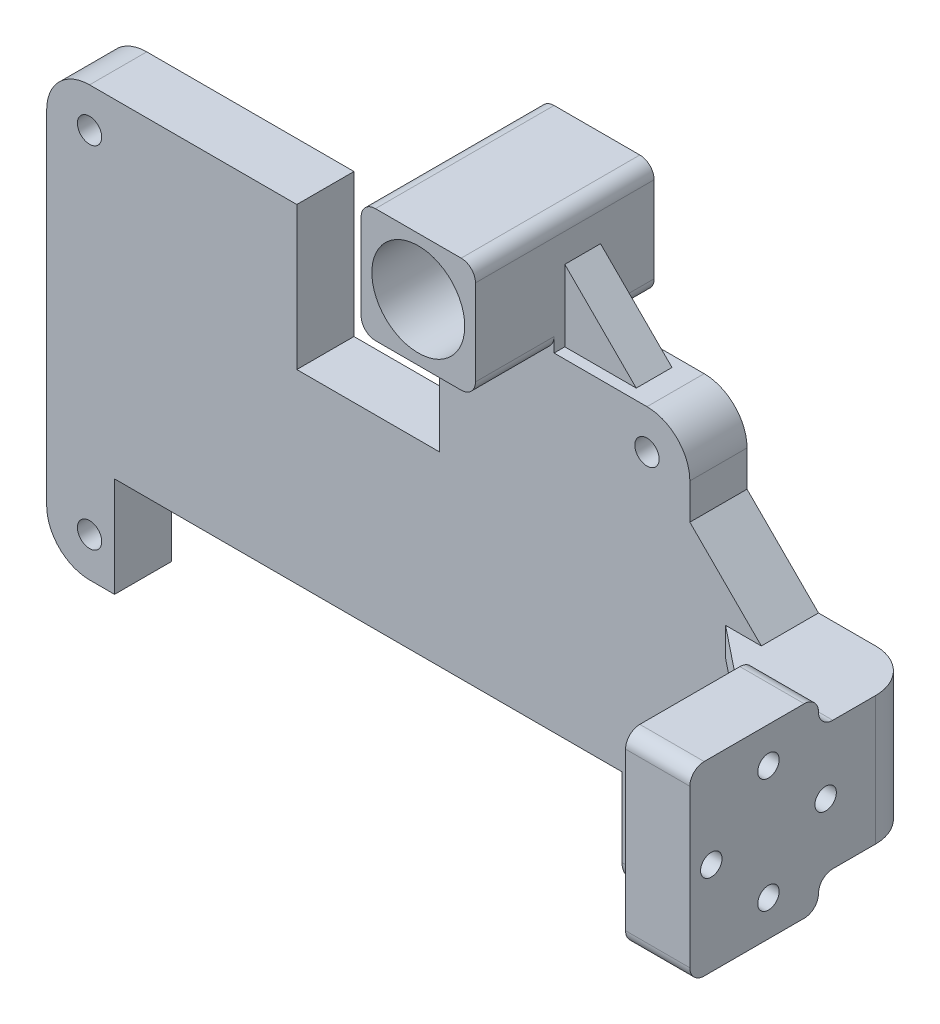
SolidWorks part; units mm, degrees
ref_plane "前视基准面" through (0, 0, 0) normal (0, 0, 1) x (1, 0, 0)
ref_plane "上视基准面" through (0, 0, 0) normal (0, 1, 0) x (1, 0, 0)
ref_plane "右视基准面" through (0, 0, 0) normal (1, 0, 0) x (0, 0, -1)
sketch "草图4" plane through (0, 0, 0) normal (0, 0, 1) x (1, 0, 0)
  line L1 (-45, 30) -> (45, 30)
  line L2 (-45, 30) -> (-45, -30)
  line L3 (-45, -30) -> (45, -30)
  line L4 (45, 30) -> (45, -30)
  line L5 (-45, 30) -> (45, -30) construction
  line L6 (-45, -30) -> (45, 30) construction
  line L7 (-39, 24.5) -> (39, 24.5) construction
  line L8 (-39, 24.5) -> (-39, -24.5) construction
  line L9 (-39, -24.5) -> (39, -24.5) construction
  line L10 (39, 24.5) -> (39, -24.5) construction
  line L11 (-39, 24.5) -> (39, -24.5) construction
  line L12 (-39, -24.5) -> (39, 24.5) construction
  circle A0 centre (-39, -24.5) radius 1.7
  circle A1 centre (-39, 24.5) radius 1.7
  circle A2 centre (39, 24.5) radius 1.7
  circle A3 centre (39, -24.5) radius 1.7
  point P0 (0, 0)
  point P6 (0, 0)
  dimension "D5" = 3.4
  dimension "D6" = 3.4
  dimension "D7" = 3.4
  dimension "D8" = 3.4
  dimension "D1" = 90
  dimension "D2" = 60
  dimension "D3" = 78
  dimension "D4" = 49
extrude "凸台-拉伸1" add sketch "草图4" along normal blind 8
fillet "圆角1" radius 6 3 edges at (-45, 30, 4) (-45, -30, 4) (45, 30, 4)
sketch "草图5" plane through (0, 0, 0) normal (0, 0, -1) x (-1, 0, 0)
  line L0 (0, 35.5169) -> (0, -35.0833) construction
  line L1 (-39, 30) -> (39, 30) construction
  line L2 (-10, 30) -> (10, 30)
  line L3 (-10, 30) -> (-10, 10)
  line L4 (-10, 10) -> (10, 10)
  line L5 (10, 30) -> (10, 10)
  line L6 (-10, 30) -> (10, 10) construction
  line L7 (-10, 10) -> (10, 30) construction
  point P3 (0, 20)
  dimension "D1" = 20
  dimension "D2" = 20
extrude "切除-拉伸1" cut sketch "草图5" against normal blind 8
sketch "草图6" plane through (0, 0, 0) normal (0, 0, -1) x (-1, 0, 0)
  line L0 (0, 42.4495) -> (0, -48.0107) construction
sketch "草图7" plane through (0, 0, 0) normal (0, 0, -1) x (-1, 0, 0)
  line L0 (39, -30) -> (35.5, -30) construction
  line L1 (39, -30) -> (-45, -30) construction
  line L2 (35.5, -30) -> (35.5, -16)
  line L3 (0, 42.4495) -> (0, -48.0107) construction
  line L4 (0, 14.1269) -> (0, -50.3558) construction
  line L5 (-35.5, -30) -> (-35.5, -16)
  line L6 (-35.5, -16) -> (35.5, -16)
  line L7 (-35.5, -30) -> (35.5, -30)
  dimension "D1" = 3.5
  dimension "D2" = 14
extrude "切除-拉伸2" cut sketch "草图7" against normal blind 8
sketch "草图9" plane through (0, 0, 0) normal (0, 0, -1) x (-1, 0, 0)
  line L0 (-69, 0) -> (65.546, 0) construction
  line L1 (-69, -9) -> (-45, -9)
  line L2 (-69, 9) -> (-45, 9)
  line L3 (-45, -9) -> (-45, 9)
  line L4 (-45, -30) -> (-45, 24) construction
  line L5 (-69, 9) -> (65.546, 9) construction
  line L6 (-69, -9) -> (65.546, -9) construction
  line L7 (-69, -9) -> (-69, 9)
  line L8 (-45, 9) -> (-45, 19)
  line L9 (-45, 9) -> (-55, 9)
  line L10 (-55, 9) -> (-45, 19)
  line L11 (-45, -9) -> (-45, -19)
  line L12 (-55, -9) -> (-45, -19)
  line L13 (-45, -9) -> (-55, -9)
  dimension "D3" = 24
  dimension "D4" = 10
  dimension "D5" = 10
  dimension "D2" = 9
extrude "凸台-拉伸2" add sketch "草图9" against normal blind 8 contours L7 L1 L2 M23 | L10 L2 M23 | L1 L12 M23
sketch "草图11" plane through (0, 0, 8) normal (0, 0, 1) x (1, 0, 0)
  line L0 (69, 9) -> (69, -9)
  line L1 (60, 9) -> (60, -9)
  line L2 (60, -9) -> (69, -9)
  line L3 (60, 9) -> (69, 9)
  dimension "D1" = 9
extrude "凸台-拉伸3" add sketch "草图11" along normal blind 24
sketch "草图12" plane through (69, 0, 0) normal (1, 0, 0) x (0, 0, -1)
  line L0 (9.9033, 0) -> (-49.0703, 0) construction
  line L1 (-14, -13) -> (-32, -13)
  line L2 (-14, -13) -> (-14, 13)
  line L3 (-14, 13) -> (-32, 13)
  line L4 (-32, -13) -> (-32, 13)
  line L5 (-14, -13) -> (-32, 13) construction
  line L6 (-14, 13) -> (-32, -13) construction
  line L7 (-32, -9) -> (-32, 9) construction
  point P0 (-23, 0)
  dimension "D1" = 18
  dimension "D2" = 26
extrude "凸台-拉伸4" add sketch "草图12" against normal blind 9
sketch "草图13" plane through (69, 0, 0) normal (1, 0, 0) x (0, 0, -1)
  line L0 (-47.3628, 0) -> (12.7852, 0) construction
  line L1 (-32, 13) -> (-14, -13) construction
  line L2 (-14, 13) -> (-32, -13) construction
  line L3 (-23, 5.0481) -> (-23, -5.2488) construction
  line L4 (-21, 5.0481) -> (-21, -5.2488) construction
  circle A0 centre (-21, 0) radius 8 construction
  circle A1 centre (-13, 0) radius 1.5
  circle A2 centre (-21, -8) radius 1.5
  circle A3 centre (-29, 0) radius 1.5
  circle A4 centre (-21, 8) radius 1.5
  point P11 (-23, 0)
  point P12 (-23, 0)
  point P17 (-21, 0)
  point P18 (-21, 0)
  point P32 (-21, 0)
  dimension "D2" = 16
  dimension "D3" = 3
  dimension "D1" = 2
  dimension "D4" = 4
extrude "切除-拉伸3" cut sketch "草图13" against normal blind 9
ref_plane "基准面4" through (0, 5, 0) normal (0, 1, 0) x (1, 0, 0)
sketch "草图14" plane through (0, 5, 0) normal (0, 1, 0) x (1, 0, 0)
  line L0 (60, -8) -> (50, -8)
  line L1 (55, -8) -> (45, -8) construction
  line L2 (60, -8) -> (60, -16)
  line L3 (60, -14) -> (60, -32) construction
  line L4 (50, -8) -> (60, -16)
  dimension "D1" = 8
extrude "凸台-拉伸5" add sketch "草图14" along normal blind 4
mirror "镜向1" about plane through (0, 0, 0) normal (0, 1, 0) of "凸台-拉伸5"
fillet "圆角2" radius 6 1 edges at (69, 0, 0)
fillet "圆角3" radius 2 6 edges at (64.5, -13, 14) (64.5, -9, 14) (64.5, -13, 32) (64.5, 13, 32) (64.5, 9, 14) (64.5, 13, 14)
sketch "草图15" plane through (0, 30, 0) normal (0, 1, 0) x (1, 0, 0)
  line L0 (39, 0) -> (10, 0) construction
  line L1 (10, -19) -> (26, -19)
  line L2 (10, -19) -> (10, 6)
  line L3 (10, 6) -> (26, 6)
  line L4 (26, -19) -> (26, 6)
  line L5 (10, -19) -> (26, 6) construction
  line L6 (10, 6) -> (26, -19) construction
  line L7 (10, -8) -> (10, 0) construction
  point P0 (18, -6.5)
  dimension "D1" = 16
  dimension "D2" = 25
  dimension "D3" = 6
extrude "凸台-拉伸6" add sketch "草图15" along normal blind 16
sketch "草图16" plane through (0, 0, 19) normal (0, 0, 1) x (1, 0, 0)
  line L0 (10, 46) -> (26, 30) construction
  line L1 (26, 46) -> (10, 30) construction
  circle A0 centre (18, 38) radius 6.5
  point P8 (18, 38)
  dimension "D1" = 13
extrude "切除-拉伸4" cut sketch "草图16" against normal through all
ref_plane "基准面5" through (0, 0, 4) normal (0, 0, 1) x (1, 0, 0)
sketch "草图17" plane through (0, 0, 4) normal (0, 0, 1) x (1, 0, 0)
  line L0 (26, 40) -> (36, 30)
  line L1 (26, 46) -> (26, 30) construction
  line L2 (39, 30) -> (26, 30) construction
  dimension "D1" = 10
  dimension "D2" = 10
rib "筋1" sketch "草图17" sketch "草图17" thickness 5 extrusion direction parallel to sketch draft on no parameters "D1"=5
ref_plane "基准面6" through (18, 0, 0) normal (1, 0, 0) x (0, 0, -1)
sketch "草图18" plane through (18, 0, 0) normal (1, 0, 0) x (0, 0, -1)
  line L0 (6, 30) -> (0, 24)
  line L1 (0, 42.4495) -> (0, -48.0107) construction
  dimension "D1" = 6
rib "筋2" sketch "草图18" sketch "草图18" thickness 10 extrusion direction parallel to sketch draft on no parameters "D1"=10
fillet "圆角4" radius 2 6 edges at (10, 30, 13.5) (10, 30, -3) (26, 30, -3) (26, 30, 13.5) (26, 46, 6.5) (10, 46, 6.5)
fillet "圆角5" radius 3 2 edges at (40.25, -30, 0) (40.25, -30, 8)
